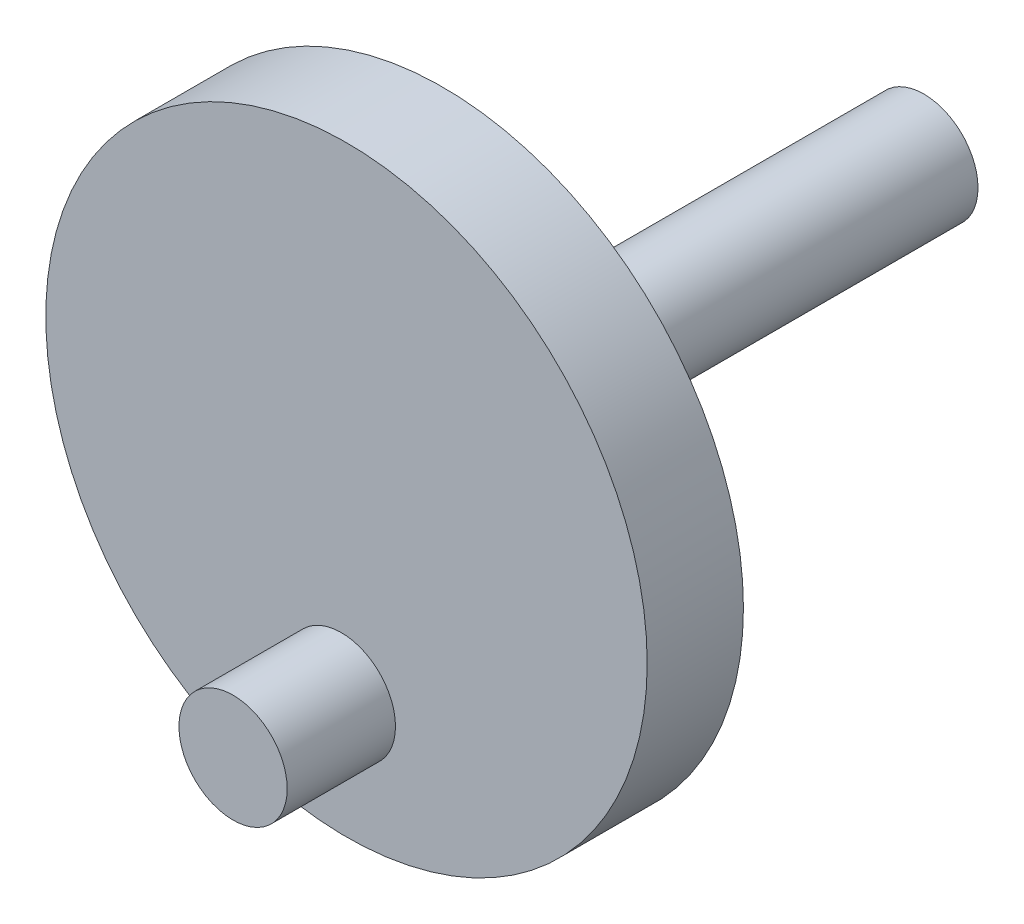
SolidWorks part; units mm, degrees
ref_plane "Face" through (0, 0, 0) normal (0, 0, 1) x (1, 0, 0)
ref_plane "Dessus" through (0, 0, 0) normal (0, 1, 0) x (1, 0, 0)
ref_plane "Droite" through (0, 0, 0) normal (1, 0, 0) x (0, 0, -1)
sketch "Esquisse1" plane through (0, 0, 0) normal (0, 0, 1) x (1, 0, 0)
  line L0 (0, 0) -> (-1.0287, -24.9788) construction
  circle A0 centre (0, 0) radius 25
  dimension "D1" = 50
extrude "Boss.-Extru.1" add sketch "Esquisse1" along normal blind 8
sketch "Esquisse2" plane through (0, 0, 8) normal (0, 0, 1) x (1, 0, 0)
  circle A0 centre (-0.4292, -14.9939) radius 4.5
  circle A1 centre (0, 0) radius 25 construction
  dimension "D1" = 9
  dimension "D2" = 15
extrude "Boss.-Extru.2" add sketch "Esquisse2" along normal blind 9
sketch "Esquisse4" plane through (0, 0, 0) normal (0, 0, -1) x (-1, 0, 0)
  circle A0 centre (0, 0) radius 4.5
  dimension "D1" = 9
extrude "Boss.-Extru.3" add sketch "Esquisse4" along normal blind 40
